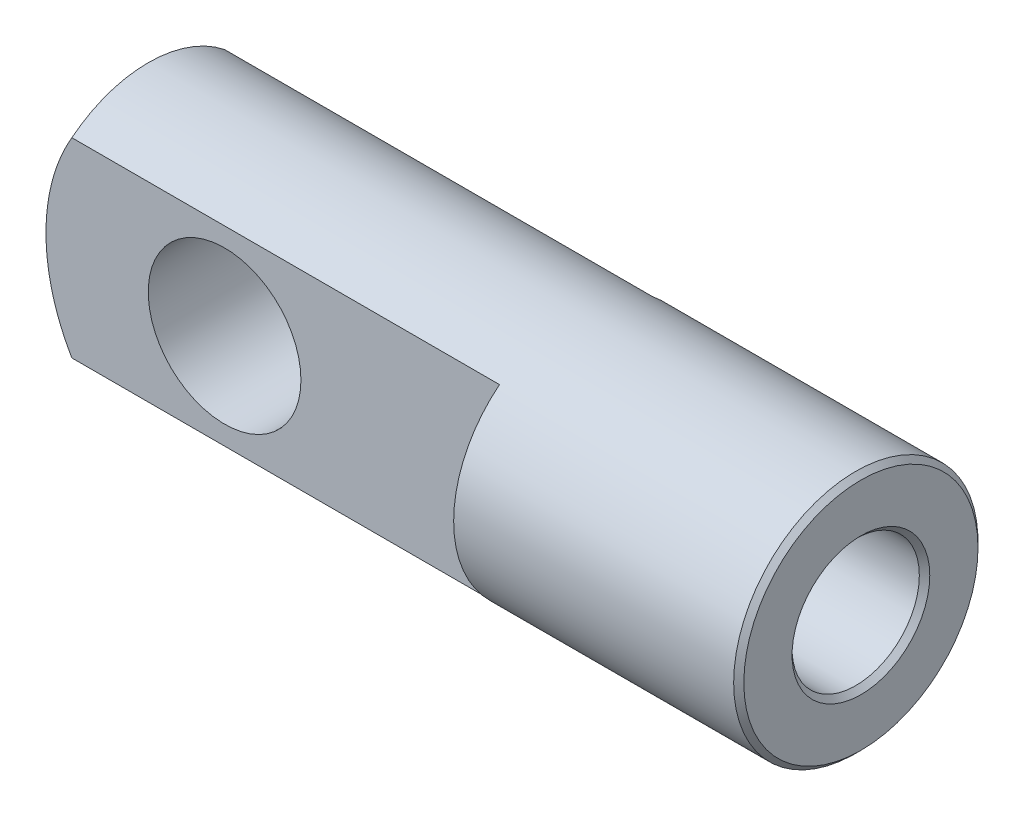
SolidWorks part; units mm, degrees
ref_plane "Спереди" through (0, 0, 0) normal (0, 0, 1) x (1, 0, 0)
ref_plane "Сверху" through (0, 0, 0) normal (0, 1, 0) x (1, 0, 0)
ref_plane "Справа" through (0, 0, 0) normal (1, 0, 0) x (0, 0, -1)
sketch "Эскиз1" plane through (0, 0, 0) normal (0, 0, 1) x (1, 0, 0)
  line L0 (0, 0) -> (0, 23)
  line L1 (0, 0) -> (-148, 0)
  line L2 (-148, 0) -> (5.9349, 0) construction
  line L3 (-1, 24) -> (-140, 24)
  line L4 (0, 23) -> (-1, 24)
  arc A0 (-148, 0) -> (-140, 24) centre (-108, 0) cw
  point P7 (0, 24)
  dimension "D1" = 148
  dimension "D2" = 24
  dimension "D3" = 40
revolve "Повернуть1" add sketch "Эскиз1" angle 360 about L2
ref_plane "Плоскость2" through (0, 20, 0) normal (0, 1, 0) x (1, 0, 0)
sketch "Эскиз2" plane through (0, 20, 0) normal (0, 1, 0) x (1, 0, 0)
  line L0 (-148, -15) -> (-148, 15)
  line L1 (-148, 15) -> (-56, 15)
  line L2 (-56, 15) -> (-56, 26.1852)
  line L3 (-56, 26.1852) -> (-165.1069, 26.1852)
  line L4 (0, 0) -> (-134.5828, 0) construction
  line L5 (-165.1069, 26.1852) -> (-165.1069, -26.1852)
  line L6 (-148, -15) -> (-56, -15)
  line L7 (-56, -15) -> (-56, -26.1852)
  line L8 (-56, -26.1852) -> (-165.1069, -26.1852)
  arc A0 (-140, 24) -> (-140, -24) centre (-108, 0) ccw construction
  point P13 (-148, 0)
  point P16 (-165.1069, 0)
  dimension "D1" = 92
  dimension "D2" = 30
extrude "Вырез-Вытянуть1" cut sketch "Эскиз2" against normal blind 50
sketch "Эскиз3" plane through (0, 0, 15) normal (0, 0, 1) x (1, 0, 0)
  line L0 (0, -24) -> (0, 24) construction
  line L1 (0, 0) -> (-155.3639, 0) construction
  circle A0 centre (-110, 0) radius 15
  dimension "D1" = 30
  dimension "D2" = 110
extrude "Вырез-Вытянуть2" cut sketch "Эскиз3" against normal blind 30
hole_wizard "Отверстие обработанное метчиком M27x21" positions "Эскиз5" profile "Эскиз4" tap size "M27x2" standard "GOST"
sketch "Эскиз5" plane through (0, 0, 0) normal (1, 0, 0) x (0, 0, -1)
  point P0 (0, 0)
sketch "Эскиз4" plane through (0, 0, 0) normal (0, 1, 0) x (0, 0, -1)
  line L0 (0, 0) -> (0, 43.0108)
  line L1 (0, 43.0108) -> (12.5, 35.5)
  line L2 (12.5, 35.5) -> (12.5, 1.025)
  line L3 (12.5, 1.025) -> (13.525, 0)
  line L5 (13.525, 0) -> (0, 0)
  line L6 (-12.5, 1.025) -> (-13.525, 0) construction
  line L10 (0, 43.0108) -> (-12.5, 35.5) construction
  line L11 (0, -6.35) -> (0, 107.95) construction
  dimension "Диаметр сверла" = 25
  dimension "Глубина сверла" = 35.5
  dimension "Диаметр передней зенковки" = 27.05
  dimension "Угол передней зенковки" = 90
  dimension "Угол заточки сверла" = 118
